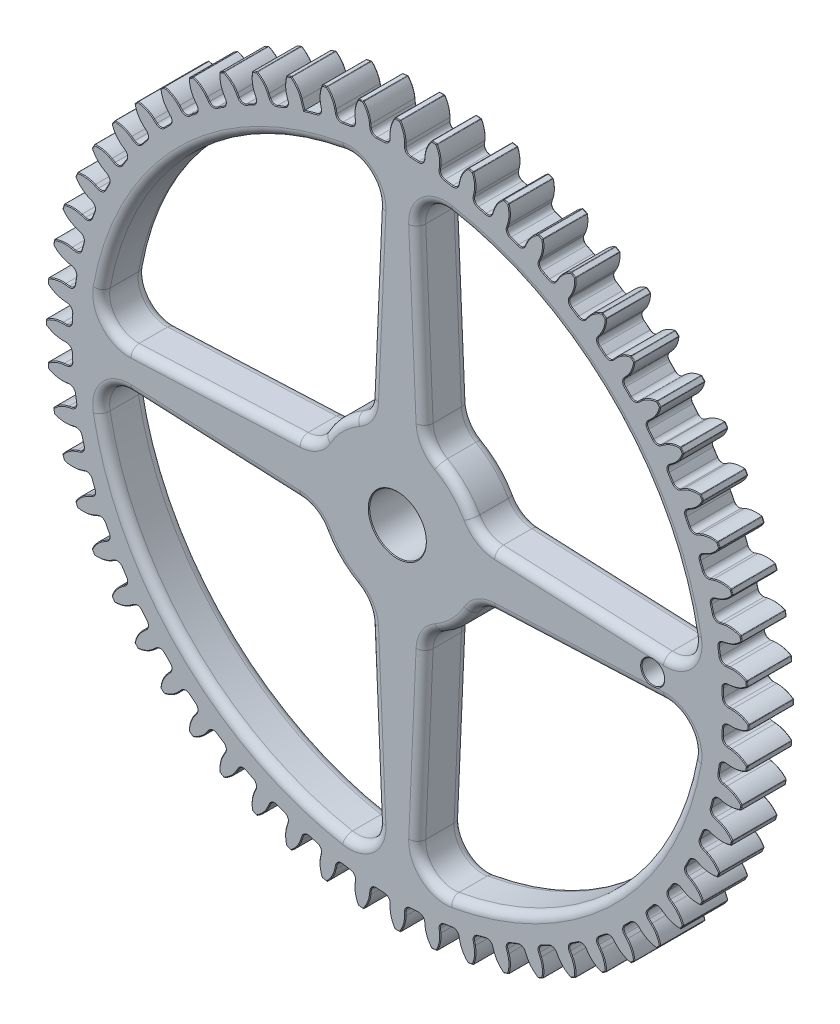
SolidWorks part; units mm, degrees
ref_plane "Спереди" through (0, 0, 0) normal (0, 0, 1) x (1, 0, 0)
ref_plane "Сверху" through (0, 0, 0) normal (0, 1, 0) x (1, 0, 0)
ref_plane "Справа" through (0, 0, 0) normal (1, 0, 0) x (0, 0, -1)
sketch "Эскиз1" plane through (0, 0, 0) normal (0, 0, 1) x (1, 0, 0)
  line L0 (0, 0) -> (0, 124) construction
  line L1 (0, 0) -> (-124, 0) construction
  line L2 (2.8, 118.1107) -> (2.8, 116.8103)
  line L3 (-2.8, 118.1107) -> (-2.8, 116.8103)
  line L4 (9.5613, 117.7564) -> (9.4253, 116.4631)
  line L5 (15.1306, 117.171) -> (14.9947, 115.8777)
  line L6 (21.8178, 116.1119) -> (21.5474, 114.8398)
  line L7 (27.2954, 114.9476) -> (27.025, 113.6755)
  line L8 (33.8353, 113.1952) -> (33.4334, 111.9584)
  line L9 (39.1612, 111.4647) -> (38.7593, 110.2279)
  line L10 (45.482, 109.0384) -> (44.9531, 107.8504)
  line L11 (50.5979, 106.7607) -> (50.0689, 105.5726)
  line L12 (56.6305, 103.6869) -> (55.9803, 102.5607)
  line L13 (61.4802, 100.8869) -> (60.83, 99.7607)
  line L14 (67.1585, 97.1994) -> (66.3941, 96.1473)
  line L15 (71.689, 93.9078) -> (70.9246, 92.8557)
  line L16 (76.9507, 89.647) -> (76.0805, 88.6805)
  line L17 (81.1123, 85.8998) -> (80.2421, 84.9334)
  line L18 (85.8998, 81.1123) -> (84.9334, 80.2421)
  line L19 (89.647, 76.9507) -> (88.6805, 76.0805)
  line L20 (93.9078, 71.689) -> (92.8557, 70.9246)
  line L21 (97.1994, 67.1585) -> (96.1473, 66.3941)
  line L22 (100.8869, 61.4802) -> (99.7607, 60.83)
  line L23 (103.6869, 56.6305) -> (102.5607, 55.9803)
  line L24 (106.7607, 50.5979) -> (105.5726, 50.0689)
  line L25 (109.0384, 45.482) -> (107.8504, 44.9531)
  line L26 (111.4647, 39.1612) -> (110.2279, 38.7593)
  line L27 (113.1952, 33.8353) -> (111.9584, 33.4334)
  line L28 (114.9476, 27.2954) -> (113.6755, 27.025)
  line L29 (116.1119, 21.8178) -> (114.8398, 21.5474)
  line L30 (117.171, 15.1306) -> (115.8777, 14.9947)
  line L31 (117.7564, 9.5613) -> (116.4631, 9.4253)
  line L32 (118.1107, 2.8) -> (116.8103, 2.8)
  line L33 (118.1107, -2.8) -> (116.8103, -2.8)
  line L34 (117.7564, -9.5613) -> (116.4631, -9.4253)
  line L35 (117.171, -15.1306) -> (115.8777, -14.9947)
  line L36 (116.1119, -21.8178) -> (114.8398, -21.5474)
  line L37 (114.9476, -27.2954) -> (113.6755, -27.025)
  line L38 (113.1952, -33.8353) -> (111.9584, -33.4334)
  line L39 (111.4647, -39.1612) -> (110.2279, -38.7593)
  line L40 (109.0384, -45.482) -> (107.8504, -44.9531)
  line L41 (106.7607, -50.5979) -> (105.5726, -50.0689)
  line L42 (103.6869, -56.6305) -> (102.5607, -55.9803)
  line L43 (100.8869, -61.4802) -> (99.7607, -60.83)
  line L44 (97.1994, -67.1585) -> (96.1473, -66.3941)
  line L45 (93.9078, -71.689) -> (92.8557, -70.9246)
  line L46 (89.647, -76.9507) -> (88.6805, -76.0805)
  line L47 (85.8998, -81.1123) -> (84.9334, -80.2421)
  line L48 (81.1123, -85.8998) -> (80.2421, -84.9334)
  line L49 (76.9507, -89.647) -> (76.0805, -88.6805)
  line L50 (71.689, -93.9078) -> (70.9246, -92.8557)
  line L51 (67.1585, -97.1994) -> (66.3941, -96.1473)
  line L52 (61.4802, -100.8869) -> (60.83, -99.7607)
  line L53 (56.6305, -103.6869) -> (55.9803, -102.5607)
  line L54 (50.5979, -106.7607) -> (50.0689, -105.5726)
  line L55 (45.482, -109.0384) -> (44.9531, -107.8504)
  line L56 (39.1612, -111.4647) -> (38.7593, -110.2279)
  line L57 (33.8353, -113.1952) -> (33.4334, -111.9584)
  line L58 (27.2954, -114.9476) -> (27.025, -113.6755)
  line L59 (21.8178, -116.1119) -> (21.5474, -114.8398)
  line L60 (15.1306, -117.171) -> (14.9947, -115.8777)
  line L61 (9.5613, -117.7564) -> (9.4253, -116.4631)
  line L62 (2.8, -118.1107) -> (2.8, -116.8103)
  line L63 (-2.8, -118.1107) -> (-2.8, -116.8103)
  line L64 (-9.5613, -117.7564) -> (-9.4253, -116.4631)
  line L65 (-15.1306, -117.171) -> (-14.9947, -115.8777)
  line L66 (-21.8178, -116.1119) -> (-21.5474, -114.8398)
  line L67 (-27.2954, -114.9476) -> (-27.025, -113.6755)
  line L68 (-33.8353, -113.1952) -> (-33.4334, -111.9584)
  line L69 (-39.1612, -111.4647) -> (-38.7593, -110.2279)
  line L70 (-45.482, -109.0384) -> (-44.9531, -107.8504)
  line L71 (-50.5979, -106.7607) -> (-50.0689, -105.5726)
  line L72 (-56.6305, -103.6869) -> (-55.9803, -102.5607)
  line L73 (-61.4802, -100.8869) -> (-60.83, -99.7607)
  line L74 (-67.1585, -97.1994) -> (-66.3941, -96.1473)
  line L75 (-71.689, -93.9078) -> (-70.9246, -92.8557)
  line L76 (-76.9507, -89.647) -> (-76.0805, -88.6805)
  line L77 (-81.1123, -85.8998) -> (-80.2421, -84.9334)
  line L78 (-85.8998, -81.1123) -> (-84.9334, -80.2421)
  line L79 (-89.647, -76.9507) -> (-88.6805, -76.0805)
  line L80 (-93.9078, -71.689) -> (-92.8557, -70.9246)
  line L81 (-97.1994, -67.1585) -> (-96.1473, -66.3941)
  line L82 (-100.8869, -61.4802) -> (-99.7607, -60.83)
  line L83 (-103.6869, -56.6305) -> (-102.5607, -55.9803)
  line L84 (-106.7607, -50.5979) -> (-105.5726, -50.0689)
  line L85 (-109.0384, -45.482) -> (-107.8504, -44.9531)
  line L86 (-111.4647, -39.1612) -> (-110.2279, -38.7593)
  line L87 (-113.1952, -33.8353) -> (-111.9584, -33.4334)
  line L88 (-114.9476, -27.2954) -> (-113.6755, -27.025)
  line L89 (-116.1119, -21.8178) -> (-114.8398, -21.5474)
  line L90 (-117.171, -15.1306) -> (-115.8777, -14.9947)
  line L91 (-117.7564, -9.5613) -> (-116.4631, -9.4253)
  line L92 (-118.1107, -2.8) -> (-116.8103, -2.8)
  line L93 (-118.1107, 2.8) -> (-116.8103, 2.8)
  line L94 (-117.7564, 9.5613) -> (-116.4631, 9.4253)
  line L95 (-117.171, 15.1306) -> (-115.8777, 14.9947)
  line L96 (-116.1119, 21.8178) -> (-114.8398, 21.5474)
  line L97 (-114.9476, 27.2954) -> (-113.6755, 27.025)
  line L98 (-113.1952, 33.8353) -> (-111.9584, 33.4334)
  line L99 (-111.4647, 39.1612) -> (-110.2279, 38.7593)
  line L100 (-109.0384, 45.482) -> (-107.8504, 44.9531)
  line L101 (-106.7607, 50.5979) -> (-105.5726, 50.0689)
  line L102 (-103.6869, 56.6305) -> (-102.5607, 55.9803)
  line L103 (-100.8869, 61.4802) -> (-99.7607, 60.83)
  line L104 (-97.1994, 67.1585) -> (-96.1473, 66.3941)
  line L105 (-93.9078, 71.689) -> (-92.8557, 70.9246)
  line L106 (-89.647, 76.9507) -> (-88.6805, 76.0805)
  line L107 (-85.8998, 81.1123) -> (-84.9334, 80.2421)
  line L108 (-81.1123, 85.8998) -> (-80.2421, 84.9334)
  line L109 (-76.9507, 89.647) -> (-76.0805, 88.6805)
  line L110 (-71.689, 93.9078) -> (-70.9246, 92.8557)
  line L111 (-67.1585, 97.1994) -> (-66.3941, 96.1473)
  line L112 (-61.4802, 100.8869) -> (-60.83, 99.7607)
  line L113 (-56.6305, 103.6869) -> (-55.9803, 102.5607)
  line L114 (-50.5979, 106.7607) -> (-50.0689, 105.5726)
  line L115 (-45.482, 109.0384) -> (-44.9531, 107.8504)
  line L116 (-39.1612, 111.4647) -> (-38.7593, 110.2279)
  line L117 (-33.8353, 113.1952) -> (-32.8635, 110.2043)
  line L118 (-27.2954, 114.9476) -> (-27.025, 113.6755)
  line L119 (-21.8178, 116.1119) -> (-21.5474, 114.8398)
  line L120 (-15.1306, 117.171) -> (-14.9947, 115.8777)
  line L121 (-9.5613, 117.7564) -> (-9.4253, 116.4631)
  arc A0 (0.8842, 123.9968) -> (-0.8842, 123.9968) centre (0, 0) ccw
  arc A1 (-4.6283, 114.9068) -> (-7.4081, 114.7611) centre (0, 0) ccw
  circle A2 centre (0, 0) radius 118.33 construction
  arc A3 (-0.8842, 123.9968) -> (-2.8, 118.1107) centre (7.2, 118.1107) ccw
  arc A4 (0.8842, 123.9968) -> (2.8, 118.1107) centre (-7.2, 118.1107) cw
  arc A5 (12.0819, 123.41) -> (9.5613, 117.7564) centre (19.5065, 116.7111) ccw
  arc A6 (13.8405, 123.2252) -> (12.0819, 123.41) centre (0, 0) ccw
  arc A7 (13.8405, 123.2252) -> (15.1306, 117.171) centre (5.1854, 118.2163) cw
  arc A8 (24.9155, 121.471) -> (21.8178, 116.1119) centre (31.5993, 114.0328) ccw
  arc A9 (26.6452, 121.1034) -> (24.9155, 121.471) centre (0, 0) ccw
  arc A10 (26.6452, 121.1034) -> (27.2954, 114.9476) centre (17.5139, 117.0267) cw
  arc A11 (37.4762, 118.2012) -> (33.8353, 113.1952) centre (43.3458, 110.1051) ccw
  arc A12 (39.158, 117.6548) -> (37.4762, 118.2012) centre (0, 0) ccw
  arc A13 (39.158, 117.6548) -> (39.1612, 111.4647) centre (29.6506, 114.5549) cw
  arc A14 (49.6263, 113.6364) -> (45.482, 109.0384) centre (54.6175, 104.971) ccw
  arc A15 (51.2418, 112.9171) -> (49.6263, 113.6364) centre (0, 0) ccw
  arc A16 (51.2418, 112.9171) -> (50.5979, 106.7607) centre (41.4624, 110.828) cw
  arc A17 (61.2327, 107.8265) -> (56.6305, 103.6869) centre (65.2908, 98.6869) ccw
  arc A18 (62.7641, 106.9423) -> (61.2327, 107.8265) centre (0, 0) ccw
  arc A19 (62.7641, 106.9423) -> (61.4802, 100.8869) centre (52.82, 105.8869) cw
  arc A20 (72.1682, 100.8353) -> (67.1585, 97.1994) centre (75.2487, 91.3215) ccw
  arc A21 (73.5988, 99.7959) -> (72.1682, 100.8353) centre (0, 0) ccw
  arc A22 (73.5988, 99.7959) -> (71.689, 93.9078) centre (63.5988, 99.7857) cw
  arc A23 (82.313, 92.7392) -> (76.9507, 89.647) centre (84.3822, 82.9557) ccw
  arc A24 (83.6272, 91.556) -> (82.313, 92.7392) centre (0, 0) ccw
  arc A25 (83.6272, 91.556) -> (81.1123, 85.8998) centre (73.6809, 92.5911) cw
  arc A26 (91.556, 83.6272) -> (85.8998, 81.1123) centre (92.5911, 73.6809) ccw
  arc A27 (92.7392, 82.313) -> (91.556, 83.6272) centre (0, 0) ccw
  arc A28 (92.7392, 82.313) -> (89.647, 76.9507) centre (82.9557, 84.3822) cw
  arc A29 (99.7959, 73.5988) -> (93.9078, 71.689) centre (99.7857, 63.5988) ccw
  arc A30 (100.8353, 72.1682) -> (99.7959, 73.5988) centre (0, 0) ccw
  arc A31 (100.8353, 72.1682) -> (97.1994, 67.1585) centre (91.3215, 75.2487) cw
  arc A32 (106.9423, 62.7641) -> (100.8869, 61.4802) centre (105.8869, 52.82) ccw
  arc A33 (107.8265, 61.2327) -> (106.9423, 62.7641) centre (0, 0) ccw
  arc A34 (107.8265, 61.2327) -> (103.6869, 56.6305) centre (98.6869, 65.2908) cw
  arc A35 (112.9171, 51.2418) -> (106.7607, 50.5979) centre (110.828, 41.4624) ccw
  arc A36 (113.6364, 49.6263) -> (112.9171, 51.2418) centre (0, 0) ccw
  arc A37 (113.6364, 49.6263) -> (109.0384, 45.482) centre (104.971, 54.6175) cw
  arc A38 (117.6548, 39.158) -> (111.4647, 39.1612) centre (114.5549, 29.6506) ccw
  arc A39 (118.2012, 37.4762) -> (117.6548, 39.158) centre (0, 0) ccw
  arc A40 (118.2012, 37.4762) -> (113.1952, 33.8353) centre (110.1051, 43.3458) cw
  arc A41 (121.1034, 26.6452) -> (114.9476, 27.2954) centre (117.0267, 17.5139) ccw
  arc A42 (121.471, 24.9155) -> (121.1034, 26.6452) centre (0, 0) ccw
  arc A43 (121.471, 24.9155) -> (116.1119, 21.8178) centre (114.0328, 31.5993) cw
  arc A44 (123.2252, 13.8405) -> (117.171, 15.1306) centre (118.2163, 5.1854) ccw
  arc A45 (123.41, 12.0819) -> (123.2252, 13.8405) centre (0, 0) ccw
  arc A46 (123.41, 12.0819) -> (117.7564, 9.5613) centre (116.7111, 19.5065) cw
  arc A47 (123.9968, 0.8842) -> (118.1107, 2.8) centre (118.1107, -7.2) ccw
  arc A48 (123.9968, -0.8842) -> (123.9968, 0.8842) centre (0, 0) ccw
  arc A49 (123.9968, -0.8842) -> (118.1107, -2.8) centre (118.1107, 7.2) cw
  arc A50 (123.41, -12.0819) -> (117.7564, -9.5613) centre (116.7111, -19.5065) ccw
  arc A51 (123.2252, -13.8405) -> (123.41, -12.0819) centre (0, 0) ccw
  arc A52 (123.2252, -13.8405) -> (117.171, -15.1306) centre (118.2163, -5.1854) cw
  arc A53 (121.471, -24.9155) -> (116.1119, -21.8178) centre (114.0328, -31.5993) ccw
  arc A54 (121.1034, -26.6452) -> (121.471, -24.9155) centre (0, 0) ccw
  arc A55 (121.1034, -26.6452) -> (114.9476, -27.2954) centre (117.0267, -17.5139) cw
  arc A56 (118.2012, -37.4762) -> (113.1952, -33.8353) centre (110.1051, -43.3458) ccw
  arc A57 (117.6548, -39.158) -> (118.2012, -37.4762) centre (0, 0) ccw
  arc A58 (117.6548, -39.158) -> (111.4647, -39.1612) centre (114.5549, -29.6506) cw
  arc A59 (113.6364, -49.6263) -> (109.0384, -45.482) centre (104.971, -54.6175) ccw
  arc A60 (112.9171, -51.2418) -> (113.6364, -49.6263) centre (0, 0) ccw
  arc A61 (112.9171, -51.2418) -> (106.7607, -50.5979) centre (110.828, -41.4624) cw
  arc A62 (107.8265, -61.2327) -> (103.6869, -56.6305) centre (98.6869, -65.2908) ccw
  arc A63 (106.9423, -62.7641) -> (107.8265, -61.2327) centre (0, 0) ccw
  arc A64 (106.9423, -62.7641) -> (100.8869, -61.4802) centre (105.8869, -52.82) cw
  arc A65 (100.8353, -72.1682) -> (97.1994, -67.1585) centre (91.3215, -75.2487) ccw
  arc A66 (99.7959, -73.5988) -> (100.8353, -72.1682) centre (0, 0) ccw
  arc A67 (99.7959, -73.5988) -> (93.9078, -71.689) centre (99.7857, -63.5988) cw
  arc A68 (92.7392, -82.313) -> (89.647, -76.9507) centre (82.9557, -84.3822) ccw
  arc A69 (91.556, -83.6272) -> (92.7392, -82.313) centre (0, 0) ccw
  arc A70 (91.556, -83.6272) -> (85.8998, -81.1123) centre (92.5911, -73.6809) cw
  arc A71 (83.6272, -91.556) -> (81.1123, -85.8998) centre (73.6809, -92.5911) ccw
  arc A72 (82.313, -92.7392) -> (83.6272, -91.556) centre (0, 0) ccw
  arc A73 (82.313, -92.7392) -> (76.9507, -89.647) centre (84.3822, -82.9557) cw
  arc A74 (73.5988, -99.7959) -> (71.689, -93.9078) centre (63.5988, -99.7857) ccw
  arc A75 (72.1682, -100.8353) -> (73.5988, -99.7959) centre (0, 0) ccw
  arc A76 (72.1682, -100.8353) -> (67.1585, -97.1994) centre (75.2487, -91.3215) cw
  arc A77 (62.7641, -106.9423) -> (61.4802, -100.8869) centre (52.82, -105.8869) ccw
  arc A78 (61.2327, -107.8265) -> (62.7641, -106.9423) centre (0, 0) ccw
  arc A79 (61.2327, -107.8265) -> (56.6305, -103.6869) centre (65.2908, -98.6869) cw
  arc A80 (51.2418, -112.9171) -> (50.5979, -106.7607) centre (41.4624, -110.828) ccw
  arc A81 (49.6263, -113.6364) -> (51.2418, -112.9171) centre (0, 0) ccw
  arc A82 (49.6263, -113.6364) -> (45.482, -109.0384) centre (54.6175, -104.971) cw
  arc A83 (39.158, -117.6548) -> (39.1612, -111.4647) centre (29.6506, -114.5549) ccw
  arc A84 (37.4762, -118.2012) -> (39.158, -117.6548) centre (0, 0) ccw
  arc A85 (37.4762, -118.2012) -> (33.8353, -113.1952) centre (43.3458, -110.1051) cw
  arc A86 (26.6452, -121.1034) -> (27.2954, -114.9476) centre (17.5139, -117.0267) ccw
  arc A87 (24.9155, -121.471) -> (26.6452, -121.1034) centre (0, 0) ccw
  arc A88 (24.9155, -121.471) -> (21.8178, -116.1119) centre (31.5993, -114.0328) cw
  arc A89 (13.8405, -123.2252) -> (15.1306, -117.171) centre (5.1854, -118.2163) ccw
  arc A90 (12.0819, -123.41) -> (13.8405, -123.2252) centre (0, 0) ccw
  arc A91 (12.0819, -123.41) -> (9.5613, -117.7564) centre (19.5065, -116.7111) cw
  arc A92 (0.8842, -123.9968) -> (2.8, -118.1107) centre (-7.2, -118.1107) ccw
  arc A93 (-0.8842, -123.9968) -> (0.8842, -123.9968) centre (0, 0) ccw
  arc A94 (-0.8842, -123.9968) -> (-2.8, -118.1107) centre (7.2, -118.1107) cw
  arc A95 (-12.0819, -123.41) -> (-9.5613, -117.7564) centre (-19.5065, -116.7111) ccw
  arc A96 (-13.8405, -123.2252) -> (-12.0819, -123.41) centre (0, 0) ccw
  arc A97 (-13.8405, -123.2252) -> (-15.1306, -117.171) centre (-5.1854, -118.2163) cw
  arc A98 (-24.9155, -121.471) -> (-21.8178, -116.1119) centre (-31.5993, -114.0328) ccw
  arc A99 (-26.6452, -121.1034) -> (-24.9155, -121.471) centre (0, 0) ccw
  arc A100 (-26.6452, -121.1034) -> (-27.2954, -114.9476) centre (-17.5139, -117.0267) cw
  arc A101 (-37.4762, -118.2012) -> (-33.8353, -113.1952) centre (-43.3458, -110.1051) ccw
  arc A102 (-39.158, -117.6548) -> (-37.4762, -118.2012) centre (0, 0) ccw
  arc A103 (-39.158, -117.6548) -> (-39.1612, -111.4647) centre (-29.6506, -114.5549) cw
  arc A104 (-49.6263, -113.6364) -> (-45.482, -109.0384) centre (-54.6175, -104.971) ccw
  arc A105 (-51.2418, -112.9171) -> (-49.6263, -113.6364) centre (0, 0) ccw
  arc A106 (-51.2418, -112.9171) -> (-50.5979, -106.7607) centre (-41.4624, -110.828) cw
  arc A107 (-61.2327, -107.8265) -> (-56.6305, -103.6869) centre (-65.2908, -98.6869) ccw
  arc A108 (-62.7641, -106.9423) -> (-61.2327, -107.8265) centre (0, 0) ccw
  arc A109 (-62.7641, -106.9423) -> (-61.4802, -100.8869) centre (-52.82, -105.8869) cw
  arc A110 (-72.1682, -100.8353) -> (-67.1585, -97.1994) centre (-75.2487, -91.3215) ccw
  arc A111 (-73.5988, -99.7959) -> (-72.1682, -100.8353) centre (0, 0) ccw
  arc A112 (-73.5988, -99.7959) -> (-71.689, -93.9078) centre (-63.5988, -99.7857) cw
  arc A113 (-82.313, -92.7392) -> (-76.9507, -89.647) centre (-84.3822, -82.9557) ccw
  arc A114 (-83.6272, -91.556) -> (-82.313, -92.7392) centre (0, 0) ccw
  arc A115 (-83.6272, -91.556) -> (-81.1123, -85.8998) centre (-73.6809, -92.5911) cw
  arc A116 (-91.556, -83.6272) -> (-85.8998, -81.1123) centre (-92.5911, -73.6809) ccw
  arc A117 (-92.7392, -82.313) -> (-91.556, -83.6272) centre (0, 0) ccw
  arc A118 (-92.7392, -82.313) -> (-89.647, -76.9507) centre (-82.9557, -84.3822) cw
  arc A119 (-99.7959, -73.5988) -> (-93.9078, -71.689) centre (-99.7857, -63.5988) ccw
  arc A120 (-100.8353, -72.1682) -> (-99.7959, -73.5988) centre (0, 0) ccw
  arc A121 (-100.8353, -72.1682) -> (-97.1994, -67.1585) centre (-91.3215, -75.2487) cw
  arc A122 (-106.9423, -62.7641) -> (-100.8869, -61.4802) centre (-105.8869, -52.82) ccw
  arc A123 (-107.8265, -61.2327) -> (-106.9423, -62.7641) centre (0, 0) ccw
  arc A124 (-107.8265, -61.2327) -> (-103.6869, -56.6305) centre (-98.6869, -65.2908) cw
  arc A125 (-112.9171, -51.2418) -> (-106.7607, -50.5979) centre (-110.828, -41.4624) ccw
  arc A126 (-113.6364, -49.6263) -> (-112.9171, -51.2418) centre (0, 0) ccw
  arc A127 (-113.6364, -49.6263) -> (-109.0384, -45.482) centre (-104.971, -54.6175) cw
  arc A128 (-117.6548, -39.158) -> (-111.4647, -39.1612) centre (-114.5549, -29.6506) ccw
  arc A129 (-118.2012, -37.4762) -> (-117.6548, -39.158) centre (0, 0) ccw
  arc A130 (-118.2012, -37.4762) -> (-113.1952, -33.8353) centre (-110.1051, -43.3458) cw
  arc A131 (-121.1034, -26.6452) -> (-114.9476, -27.2954) centre (-117.0267, -17.5139) ccw
  arc A132 (-121.471, -24.9155) -> (-121.1034, -26.6452) centre (0, 0) ccw
  arc A133 (-121.471, -24.9155) -> (-116.1119, -21.8178) centre (-114.0328, -31.5993) cw
  arc A134 (-123.2252, -13.8405) -> (-117.171, -15.1306) centre (-118.2163, -5.1854) ccw
  arc A135 (-123.41, -12.0819) -> (-123.2252, -13.8405) centre (0, 0) ccw
  arc A136 (-123.41, -12.0819) -> (-117.7564, -9.5613) centre (-116.7111, -19.5065) cw
  arc A137 (-123.9968, -0.8842) -> (-118.1107, -2.8) centre (-118.1107, 7.2) ccw
  arc A138 (-123.9968, 0.8842) -> (-123.9968, -0.8842) centre (0, 0) ccw
  arc A139 (-123.9968, 0.8842) -> (-118.1107, 2.8) centre (-118.1107, -7.2) cw
  arc A140 (-123.41, 12.0819) -> (-117.7564, 9.5613) centre (-116.7111, 19.5065) ccw
  arc A141 (-123.2252, 13.8405) -> (-123.41, 12.0819) centre (0, 0) ccw
  arc A142 (-123.2252, 13.8405) -> (-117.171, 15.1306) centre (-118.2163, 5.1854) cw
  arc A143 (-121.471, 24.9155) -> (-116.1119, 21.8178) centre (-114.0328, 31.5993) ccw
  arc A144 (-121.1034, 26.6452) -> (-121.471, 24.9155) centre (0, 0) ccw
  arc A145 (-121.1034, 26.6452) -> (-114.9476, 27.2954) centre (-117.0267, 17.5139) cw
  arc A146 (-118.2012, 37.4762) -> (-113.1952, 33.8353) centre (-110.1051, 43.3458) ccw
  arc A147 (-117.6548, 39.158) -> (-118.2012, 37.4762) centre (0, 0) ccw
  arc A148 (-117.6548, 39.158) -> (-111.4647, 39.1612) centre (-114.5549, 29.6506) cw
  arc A149 (-113.6364, 49.6263) -> (-109.0384, 45.482) centre (-104.971, 54.6175) ccw
  arc A150 (-112.9171, 51.2418) -> (-113.6364, 49.6263) centre (0, 0) ccw
  arc A151 (-112.9171, 51.2418) -> (-106.7607, 50.5979) centre (-110.828, 41.4624) cw
  arc A152 (-107.8265, 61.2327) -> (-103.6869, 56.6305) centre (-98.6869, 65.2908) ccw
  arc A153 (-106.9423, 62.7641) -> (-107.8265, 61.2327) centre (0, 0) ccw
  arc A154 (-106.9423, 62.7641) -> (-100.8869, 61.4802) centre (-105.8869, 52.82) cw
  arc A155 (-100.8353, 72.1682) -> (-97.1994, 67.1585) centre (-91.3215, 75.2487) ccw
  arc A156 (-99.7959, 73.5988) -> (-100.8353, 72.1682) centre (0, 0) ccw
  arc A157 (-99.7959, 73.5988) -> (-93.9078, 71.689) centre (-99.7857, 63.5988) cw
  arc A158 (-92.7392, 82.313) -> (-89.647, 76.9507) centre (-82.9557, 84.3822) ccw
  arc A159 (-91.556, 83.6272) -> (-92.7392, 82.313) centre (0, 0) ccw
  arc A160 (-91.556, 83.6272) -> (-85.8998, 81.1123) centre (-92.5911, 73.6809) cw
  arc A161 (-83.6272, 91.556) -> (-81.1123, 85.8998) centre (-73.6809, 92.5911) ccw
  arc A162 (-82.313, 92.7392) -> (-83.6272, 91.556) centre (0, 0) ccw
  arc A163 (-82.313, 92.7392) -> (-76.9507, 89.647) centre (-84.3822, 82.9557) cw
  arc A164 (-73.5988, 99.7959) -> (-71.689, 93.9078) centre (-63.5988, 99.7857) ccw
  arc A165 (-72.1682, 100.8353) -> (-73.5988, 99.7959) centre (0, 0) ccw
  arc A166 (-72.1682, 100.8353) -> (-67.1585, 97.1994) centre (-75.2487, 91.3215) cw
  arc A167 (-62.7641, 106.9423) -> (-61.4802, 100.8869) centre (-52.82, 105.8869) ccw
  arc A168 (-61.2327, 107.8265) -> (-62.7641, 106.9423) centre (0, 0) ccw
  arc A169 (-61.2327, 107.8265) -> (-56.6305, 103.6869) centre (-65.2908, 98.6869) cw
  arc A170 (-51.2418, 112.9171) -> (-50.5979, 106.7607) centre (-41.4624, 110.828) ccw
  arc A171 (-49.6263, 113.6364) -> (-51.2418, 112.9171) centre (0, 0) ccw
  arc A172 (-49.6263, 113.6364) -> (-45.482, 109.0384) centre (-54.6175, 104.971) cw
  arc A173 (-39.158, 117.6548) -> (-39.1612, 111.4647) centre (-29.6506, 114.5549) ccw
  arc A174 (-37.4762, 118.2012) -> (-39.158, 117.6548) centre (0, 0) ccw
  arc A175 (-37.4762, 118.2012) -> (-33.8353, 113.1952) centre (-43.3458, 110.1051) cw
  arc A176 (-26.6452, 121.1034) -> (-27.2954, 114.9476) centre (-17.5139, 117.0267) ccw
  arc A177 (-24.9155, 121.471) -> (-26.6452, 121.1034) centre (0, 0) ccw
  arc A178 (-24.9155, 121.471) -> (-21.8178, 116.1119) centre (-31.5993, 114.0328) cw
  arc A179 (-13.8405, 123.2252) -> (-15.1306, 117.171) centre (-5.1854, 118.2163) ccw
  arc A180 (-12.0819, 123.41) -> (-13.8405, 123.2252) centre (0, 0) ccw
  arc A181 (-12.0819, 123.41) -> (-9.5613, 117.7564) centre (-19.5065, 116.7111) cw
  arc A182 (-16.614, 113.7936) -> (-19.3633, 113.3581) centre (0, 0) ccw
  arc A183 (7.4081, 114.7611) -> (4.6283, 114.9068) centre (0, 0) ccw
  arc A184 (19.3633, 113.3581) -> (16.614, 113.7936) centre (0, 0) ccw
  arc A185 (31.1064, 110.7131) -> (28.4177, 111.4336) centre (0, 0) ccw
  arc A186 (42.5086, 106.8551) -> (39.91, 107.8527) centre (0, 0) ccw
  arc A187 (-28.4177, 111.4336) -> (-32.8635, 110.2043) centre (0, 0) ccw
  arc A188 (-39.91, 107.8527) -> (-42.5086, 106.8551) centre (0, 0) ccw
  arc A189 (-50.965, 103.0901) -> (-53.4452, 101.8264) centre (0, 0) ccw
  arc A190 (-61.4617, 97.1981) -> (-63.7961, 95.682) centre (0, 0) ccw
  arc A191 (-71.2849, 90.2411) -> (-73.4482, 88.4894) centre (0, 0) ccw
  arc A192 (-80.3272, 82.2955) -> (-82.2955, 80.3272) centre (0, 0) ccw
  arc A193 (-95.682, 63.7961) -> (-97.1981, 61.4617) centre (0, 0) ccw
  arc A194 (-88.4894, 73.4482) -> (-90.2411, 71.2849) centre (0, 0) ccw
  arc A195 (-101.8264, 53.4452) -> (-103.0901, 50.965) centre (0, 0) ccw
  arc A196 (-106.8551, 42.5086) -> (-107.8527, 39.91) centre (0, 0) ccw
  arc A197 (-110.7131, 31.1064) -> (-111.4336, 28.4177) centre (0, 0) ccw
  arc A198 (-113.3581, 19.3633) -> (-113.7936, 16.614) centre (0, 0) ccw
  arc A199 (-114.7611, 7.4081) -> (-114.9068, 4.6283) centre (0, 0) ccw
  arc A200 (-114.9068, -4.6283) -> (-114.7611, -7.4081) centre (0, 0) ccw
  arc A201 (53.4452, 101.8264) -> (50.965, 103.0901) centre (0, 0) ccw
  arc A202 (63.7961, 95.682) -> (61.4617, 97.1981) centre (0, 0) ccw
  arc A203 (73.4482, 88.4894) -> (71.2849, 90.2411) centre (0, 0) ccw
  arc A204 (82.2955, 80.3272) -> (80.3272, 82.2955) centre (0, 0) ccw
  arc A205 (90.2411, 71.2849) -> (88.4894, 73.4482) centre (0, 0) ccw
  arc A206 (97.1981, 61.4617) -> (95.682, 63.7961) centre (0, 0) ccw
  arc A207 (103.0901, 50.965) -> (101.8264, 53.4452) centre (0, 0) ccw
  arc A208 (107.8527, 39.91) -> (106.8551, 42.5086) centre (0, 0) ccw
  arc A209 (111.4336, 28.4177) -> (110.7131, 31.1064) centre (0, 0) ccw
  arc A210 (113.7936, 16.614) -> (113.3581, 19.3633) centre (0, 0) ccw
  arc A211 (114.9068, 4.6283) -> (114.7611, 7.4081) centre (0, 0) ccw
  arc A212 (114.7611, -7.4081) -> (114.9068, -4.6283) centre (0, 0) ccw
  arc A213 (113.3581, -19.3633) -> (113.7936, -16.614) centre (0, 0) ccw
  arc A214 (110.7131, -31.1064) -> (111.4336, -28.4177) centre (0, 0) ccw
  arc A215 (106.8551, -42.5086) -> (107.8527, -39.91) centre (0, 0) ccw
  arc A216 (101.8264, -53.4452) -> (103.0901, -50.965) centre (0, 0) ccw
  arc A217 (95.682, -63.7961) -> (97.1981, -61.4617) centre (0, 0) ccw
  arc A218 (88.4894, -73.4482) -> (90.2411, -71.2849) centre (0, 0) ccw
  arc A219 (80.3272, -82.2955) -> (82.2955, -80.3272) centre (0, 0) ccw
  arc A220 (71.2849, -90.2411) -> (73.4482, -88.4894) centre (0, 0) ccw
  arc A221 (61.4617, -97.1981) -> (63.7961, -95.682) centre (0, 0) ccw
  arc A222 (50.965, -103.0901) -> (53.4452, -101.8264) centre (0, 0) ccw
  arc A223 (39.91, -107.8527) -> (42.5086, -106.8551) centre (0, 0) ccw
  arc A224 (28.4177, -111.4336) -> (31.1064, -110.7131) centre (0, 0) ccw
  arc A225 (16.614, -113.7936) -> (19.3633, -113.3581) centre (0, 0) ccw
  arc A226 (4.6283, -114.9068) -> (7.4081, -114.7611) centre (0, 0) ccw
  arc A227 (-7.4081, -114.7611) -> (-4.6283, -114.9068) centre (0, 0) ccw
  arc A228 (-19.3633, -113.3581) -> (-16.614, -113.7936) centre (0, 0) ccw
  arc A229 (-31.1064, -110.7131) -> (-28.4177, -111.4336) centre (0, 0) ccw
  arc A230 (-42.5086, -106.8551) -> (-39.91, -107.8527) centre (0, 0) ccw
  arc A231 (-53.4452, -101.8264) -> (-50.965, -103.0901) centre (0, 0) ccw
  arc A232 (-63.7961, -95.682) -> (-61.4617, -97.1981) centre (0, 0) ccw
  arc A233 (-73.4482, -88.4894) -> (-71.2849, -90.2411) centre (0, 0) ccw
  arc A234 (-82.2955, -80.3272) -> (-80.3272, -82.2955) centre (0, 0) ccw
  arc A235 (-90.2411, -71.2849) -> (-88.4894, -73.4482) centre (0, 0) ccw
  arc A236 (-97.1981, -61.4617) -> (-95.682, -63.7961) centre (0, 0) ccw
  arc A237 (-103.0901, -50.965) -> (-101.8264, -53.4452) centre (0, 0) ccw
  arc A238 (-107.8527, -39.91) -> (-106.8551, -42.5086) centre (0, 0) ccw
  arc A239 (-111.4336, -28.4177) -> (-110.7131, -31.1064) centre (0, 0) ccw
  arc A240 (-113.7936, -16.614) -> (-113.3581, -19.3633) centre (0, 0) ccw
  arc A241 (38.7593, 110.2279) -> (39.91, 107.8527) centre (40.5711, 109.6393) ccw
  arc A242 (44.9531, 107.8504) -> (42.5086, 106.8551) centre (43.2128, 108.6252) cw
  arc A243 (50.0689, 105.5726) -> (50.965, 103.0901) centre (51.8093, 104.7978) ccw
  arc A244 (55.9803, 102.5607) -> (53.4452, 101.8264) centre (54.3305, 103.5132) cw
  arc A245 (60.83, 99.7607) -> (61.4617, 97.1981) centre (62.4798, 98.8082) ccw
  arc A246 (66.3941, 96.1473) -> (63.7961, 95.682) centre (64.8529, 97.267) cw
  arc A247 (70.9246, 92.8557) -> (71.2849, 90.2411) centre (72.4658, 91.736) ccw
  arc A248 (76.0805, 88.6805) -> (73.4482, 88.4894) centre (74.6648, 89.9552) cw
  arc A249 (80.2421, 84.9334) -> (80.3272, 82.2955) centre (81.6578, 83.6587) ccw
  arc A250 (84.9334, 80.2421) -> (82.2955, 80.3272) centre (83.6587, 81.6578) cw
  arc A251 (88.6805, 76.0805) -> (88.4894, 73.4482) centre (89.9552, 74.6648) ccw
  arc A252 (92.8557, 70.9246) -> (90.2411, 71.2849) centre (91.736, 72.4658) cw
  arc A253 (96.1473, 66.3941) -> (95.682, 63.7961) centre (97.267, 64.8529) ccw
  arc A254 (99.7607, 60.83) -> (97.1981, 61.4617) centre (98.8082, 62.4798) cw
  arc A255 (102.5607, 55.9803) -> (101.8264, 53.4452) centre (103.5132, 54.3305) ccw
  arc A256 (105.5726, 50.0689) -> (103.0901, 50.965) centre (104.7978, 51.8093) cw
  arc A257 (107.8504, 44.9531) -> (106.8551, 42.5086) centre (108.6252, 43.2128) ccw
  arc A258 (110.2279, 38.7593) -> (107.8527, 39.91) centre (109.6393, 40.5711) cw
  arc A259 (111.9584, 33.4334) -> (110.7131, 31.1064) centre (112.5471, 31.6216) ccw
  arc A260 (113.6755, 27.025) -> (111.4336, 28.4177) centre (113.2795, 28.8884) cw
  arc A261 (114.8398, 21.5474) -> (113.3581, 19.3633) centre (115.2359, 19.684) ccw
  arc A262 (115.8777, 14.9947) -> (113.7936, 16.614) centre (115.6786, 16.8892) cw
  arc A263 (116.4631, 9.4253) -> (114.7611, 7.4081) centre (116.6622, 7.5308) ccw
  arc A264 (116.8103, 2.8) -> (114.9068, 4.6283) centre (116.8103, 4.705) cw
  arc A265 (116.8103, -2.8) -> (114.9068, -4.6283) centre (116.8103, -4.705) ccw
  arc A266 (116.4631, -9.4253) -> (114.7611, -7.4081) centre (116.6622, -7.5308) cw
  arc A267 (115.8777, -14.9947) -> (113.7936, -16.614) centre (115.6786, -16.8892) ccw
  arc A268 (114.8398, -21.5474) -> (113.3581, -19.3633) centre (115.2359, -19.684) cw
  arc A269 (113.6755, -27.025) -> (111.4336, -28.4177) centre (113.2795, -28.8884) ccw
  arc A270 (111.9584, -33.4334) -> (110.7131, -31.1064) centre (112.5471, -31.6216) cw
  arc A271 (110.2279, -38.7593) -> (107.8527, -39.91) centre (109.6393, -40.5711) ccw
  arc A272 (107.8504, -44.9531) -> (106.8551, -42.5086) centre (108.6252, -43.2128) cw
  arc A273 (105.5726, -50.0689) -> (103.0901, -50.965) centre (104.7978, -51.8093) ccw
  arc A274 (102.5607, -55.9803) -> (101.8264, -53.4452) centre (103.5132, -54.3305) cw
  arc A275 (99.7607, -60.83) -> (97.1981, -61.4617) centre (98.8082, -62.4798) ccw
  arc A276 (96.1473, -66.3941) -> (95.682, -63.7961) centre (97.267, -64.8529) cw
  arc A277 (92.8557, -70.9246) -> (90.2411, -71.2849) centre (91.736, -72.4658) ccw
  arc A278 (88.6805, -76.0805) -> (88.4894, -73.4482) centre (89.9552, -74.6648) cw
  arc A279 (84.9334, -80.2421) -> (82.2955, -80.3272) centre (83.6587, -81.6578) ccw
  arc A280 (80.2421, -84.9334) -> (80.3272, -82.2955) centre (81.6578, -83.6587) cw
  arc A281 (76.0805, -88.6805) -> (73.4482, -88.4894) centre (74.6648, -89.9552) ccw
  arc A282 (70.9246, -92.8557) -> (71.2849, -90.2411) centre (72.4658, -91.736) cw
  arc A283 (66.3941, -96.1473) -> (63.7961, -95.682) centre (64.8529, -97.267) ccw
  arc A284 (60.83, -99.7607) -> (61.4617, -97.1981) centre (62.4798, -98.8082) cw
  arc A285 (55.9803, -102.5607) -> (53.4452, -101.8264) centre (54.3305, -103.5132) ccw
  arc A286 (50.0689, -105.5726) -> (50.965, -103.0901) centre (51.8093, -104.7978) cw
  arc A287 (44.9531, -107.8504) -> (42.5086, -106.8551) centre (43.2128, -108.6252) ccw
  arc A288 (38.7593, -110.2279) -> (39.91, -107.8527) centre (40.5711, -109.6393) cw
  arc A289 (33.4334, -111.9584) -> (31.1064, -110.7131) centre (31.6216, -112.5471) ccw
  arc A290 (27.025, -113.6755) -> (28.4177, -111.4336) centre (28.8884, -113.2795) cw
  arc A291 (21.5474, -114.8398) -> (19.3633, -113.3581) centre (19.684, -115.2359) ccw
  arc A292 (14.9947, -115.8777) -> (16.614, -113.7936) centre (16.8892, -115.6786) cw
  arc A293 (9.4253, -116.4631) -> (7.4081, -114.7611) centre (7.5308, -116.6622) ccw
  arc A294 (2.8, -116.8103) -> (4.6283, -114.9068) centre (4.705, -116.8103) cw
  arc A295 (-2.8, -116.8103) -> (-4.6283, -114.9068) centre (-4.705, -116.8103) ccw
  arc A296 (-9.4253, -116.4631) -> (-7.4081, -114.7611) centre (-7.5308, -116.6622) cw
  arc A297 (-14.9947, -115.8777) -> (-16.614, -113.7936) centre (-16.8892, -115.6786) ccw
  arc A298 (-21.5474, -114.8398) -> (-19.3633, -113.3581) centre (-19.684, -115.2359) cw
  arc A299 (-27.025, -113.6755) -> (-28.4177, -111.4336) centre (-28.8884, -113.2795) ccw
  arc A300 (-33.4334, -111.9584) -> (-31.1064, -110.7131) centre (-31.6216, -112.5471) cw
  arc A301 (-38.7593, -110.2279) -> (-39.91, -107.8527) centre (-40.5711, -109.6393) ccw
  arc A302 (-44.9531, -107.8504) -> (-42.5086, -106.8551) centre (-43.2128, -108.6252) cw
  arc A303 (-50.0689, -105.5726) -> (-50.965, -103.0901) centre (-51.8093, -104.7978) ccw
  arc A304 (-55.9803, -102.5607) -> (-53.4452, -101.8264) centre (-54.3305, -103.5132) cw
  arc A305 (-60.83, -99.7607) -> (-61.4617, -97.1981) centre (-62.4798, -98.8082) ccw
  arc A306 (-66.3941, -96.1473) -> (-63.7961, -95.682) centre (-64.8529, -97.267) cw
  arc A307 (-70.9246, -92.8557) -> (-71.2849, -90.2411) centre (-72.4658, -91.736) ccw
  arc A308 (-76.0805, -88.6805) -> (-73.4482, -88.4894) centre (-74.6648, -89.9552) cw
  arc A309 (-80.2421, -84.9334) -> (-80.3272, -82.2955) centre (-81.6578, -83.6587) ccw
  arc A310 (-84.9334, -80.2421) -> (-82.2955, -80.3272) centre (-83.6587, -81.6578) cw
  arc A311 (-88.6805, -76.0805) -> (-88.4894, -73.4482) centre (-89.9552, -74.6648) ccw
  arc A312 (-92.8557, -70.9246) -> (-90.2411, -71.2849) centre (-91.736, -72.4658) cw
  arc A313 (-96.1473, -66.3941) -> (-95.682, -63.7961) centre (-97.267, -64.8529) ccw
  arc A314 (-99.7607, -60.83) -> (-97.1981, -61.4617) centre (-98.8082, -62.4798) cw
  arc A315 (-102.5607, -55.9803) -> (-101.8264, -53.4452) centre (-103.5132, -54.3305) ccw
  arc A316 (-105.5726, -50.0689) -> (-103.0901, -50.965) centre (-104.7978, -51.8093) cw
  arc A317 (-107.8504, -44.9531) -> (-106.8551, -42.5086) centre (-108.6252, -43.2128) ccw
  arc A318 (-110.2279, -38.7593) -> (-107.8527, -39.91) centre (-109.6393, -40.5711) cw
  arc A319 (-111.9584, -33.4334) -> (-110.7131, -31.1064) centre (-112.5471, -31.6216) ccw
  arc A320 (-113.6755, -27.025) -> (-111.4336, -28.4177) centre (-113.2795, -28.8884) cw
  arc A321 (-114.8398, -21.5474) -> (-113.3581, -19.3633) centre (-115.2359, -19.684) ccw
  arc A322 (-115.8777, -14.9947) -> (-113.7936, -16.614) centre (-115.6786, -16.8892) cw
  arc A323 (-116.4631, -9.4253) -> (-114.7611, -7.4081) centre (-116.6622, -7.5308) ccw
  arc A324 (-116.8103, -2.8) -> (-114.9068, -4.6283) centre (-116.8103, -4.705) cw
  arc A325 (-116.8103, 2.8) -> (-114.9068, 4.6283) centre (-116.8103, 4.705) ccw
  arc A326 (-116.4631, 9.4253) -> (-114.7611, 7.4081) centre (-116.6622, 7.5308) cw
  arc A327 (-115.8777, 14.9947) -> (-113.7936, 16.614) centre (-115.6786, 16.8892) ccw
  arc A328 (-114.8398, 21.5474) -> (-113.3581, 19.3633) centre (-115.2359, 19.684) cw
  arc A329 (-113.6755, 27.025) -> (-111.4336, 28.4177) centre (-113.2795, 28.8884) ccw
  arc A330 (-111.9584, 33.4334) -> (-110.7131, 31.1064) centre (-112.5471, 31.6216) cw
  arc A331 (-110.2279, 38.7593) -> (-107.8527, 39.91) centre (-109.6393, 40.5711) ccw
  arc A332 (-107.8504, 44.9531) -> (-106.8551, 42.5086) centre (-108.6252, 43.2128) cw
  arc A333 (-105.5726, 50.0689) -> (-103.0901, 50.965) centre (-104.7978, 51.8093) ccw
  arc A334 (-102.5607, 55.9803) -> (-101.8264, 53.4452) centre (-103.5132, 54.3305) cw
  arc A335 (-99.7607, 60.83) -> (-97.1981, 61.4617) centre (-98.8082, 62.4798) ccw
  arc A336 (-96.1473, 66.3941) -> (-95.682, 63.7961) centre (-97.267, 64.8529) cw
  arc A337 (-92.8557, 70.9246) -> (-90.2411, 71.2849) centre (-91.736, 72.4658) ccw
  arc A338 (-88.6805, 76.0805) -> (-88.4894, 73.4482) centre (-89.9552, 74.6648) cw
  arc A339 (-84.9334, 80.2421) -> (-82.2955, 80.3272) centre (-83.6587, 81.6578) ccw
  arc A340 (-80.2421, 84.9334) -> (-80.3272, 82.2955) centre (-81.6578, 83.6587) cw
  arc A341 (-76.0805, 88.6805) -> (-73.4482, 88.4894) centre (-74.6648, 89.9552) ccw
  arc A342 (-66.3941, 96.1473) -> (-63.7961, 95.682) centre (-64.8529, 97.267) ccw
  arc A343 (-70.9246, 92.8557) -> (-71.2849, 90.2411) centre (-72.4658, 91.736) cw
  arc A344 (-60.83, 99.7607) -> (-61.4617, 97.1981) centre (-62.4798, 98.8082) cw
  arc A345 (-55.9803, 102.5607) -> (-53.4452, 101.8264) centre (-54.3305, 103.5132) ccw
  arc A346 (-50.0689, 105.5726) -> (-50.965, 103.0901) centre (-51.8093, 104.7978) cw
  arc A347 (-38.7593, 110.2279) -> (-39.91, 107.8527) centre (-40.5711, 109.6393) cw
  arc A348 (-44.9531, 107.8504) -> (-42.5086, 106.8551) centre (-43.2128, 108.6252) ccw
  arc A349 (33.4334, 111.9584) -> (31.1064, 110.7131) centre (31.6216, 112.5471) cw
  arc A350 (27.025, 113.6755) -> (28.4177, 111.4336) centre (28.8884, 113.2795) ccw
  arc A351 (21.5474, 114.8398) -> (19.3633, 113.3581) centre (19.684, 115.2359) cw
  arc A352 (14.9947, 115.8777) -> (16.614, 113.7936) centre (16.8892, 115.6786) ccw
  arc A353 (9.4253, 116.4631) -> (7.4081, 114.7611) centre (7.5308, 116.6622) cw
  arc A354 (2.8, 116.8103) -> (4.6283, 114.9068) centre (4.705, 116.8103) ccw
  arc A355 (-27.025, 113.6755) -> (-28.4177, 111.4336) centre (-28.8884, 113.2795) cw
  arc A356 (-21.5474, 114.8398) -> (-19.3633, 113.3581) centre (-19.684, 115.2359) ccw
  arc A357 (-14.9947, 115.8777) -> (-16.614, 113.7936) centre (-16.8892, 115.6786) cw
  arc A358 (-9.4253, 116.4631) -> (-7.4081, 114.7611) centre (-7.5308, 116.6622) ccw
  arc A359 (-2.8, 116.8103) -> (-4.6283, 114.9068) centre (-4.705, 116.8103) cw
  circle A360 centre (0, 0) radius 10
  point P772 (2.8, 114.9659)
  point P783 (-2.8, 114.9659)
  dimension "D1" = 248
  dimension "D2" = 230
  dimension "D3" = 236.66
  dimension "D5" = 20
  dimension "D7" = 1.905
  dimension "D8" = 20
  dimension "D4" = 5.6
  dimension "D6" = 60
extrude "Бобышка-Вытянуть1" add sketch "Эскиз1" along normal mid plane 16
sketch "Эскиз2" plane through (0, 0, 0) normal (0, 0, 1) x (1, 0, 0)
  line L0 (0, 0) -> (0, 106) construction
  line L1 (0, 0) -> (-106, 0) construction
  line L2 (-7.0132, 94.0459) -> (-9.6161, 34.429)
  line L3 (-94.0459, 7.0132) -> (-34.429, 9.6161)
  line L4 (-6.5, 110.2192) -> (-6.5, 90.2959) construction
  line L5 (-109.5933, 6.5) -> (-94.9944, 6.5) construction
  line L6 (94.0459, 7.0132) -> (34.429, 9.6161)
  line L7 (7.0132, 94.0459) -> (9.6161, 34.429)
  line L8 (7.0132, -94.0459) -> (9.6161, -34.429)
  line L9 (94.0459, -7.0132) -> (34.429, -9.6161)
  line L10 (-94.0459, -7.0132) -> (-34.429, -9.6161)
  line L11 (-7.0132, -94.0459) -> (-9.6161, -34.429)
  arc A0 (-18.7749, 104.324) -> (-104.324, 18.7749) centre (0, 0) ccw
  arc A1 (-14.705, 26.1489) -> (-26.1489, 14.705) centre (0, 0) ccw
  arc A2 (-7.0132, 94.0459) -> (-18.7749, 104.324) centre (-17.0037, 94.4821) ccw
  arc A3 (-9.6161, 34.429) -> (-14.705, 26.1489) centre (-19.6066, 34.8652) cw
  arc A4 (-34.429, 9.6161) -> (-26.1489, 14.705) centre (-34.8652, 19.6066) ccw
  arc A5 (-94.0459, 7.0132) -> (-104.324, 18.7749) centre (-94.4821, 17.0037) cw
  arc A6 (9.6161, 34.429) -> (14.705, 26.1489) centre (19.6066, 34.8652) ccw
  arc A7 (26.1489, 14.705) -> (14.705, 26.1489) centre (0, 0) ccw
  arc A8 (34.429, 9.6161) -> (26.1489, 14.705) centre (34.8652, 19.6066) cw
  arc A9 (7.0132, 94.0459) -> (18.7749, 104.324) centre (17.0037, 94.4821) cw
  arc A10 (94.0459, 7.0132) -> (104.324, 18.7749) centre (94.4821, 17.0037) ccw
  arc A11 (104.324, 18.7749) -> (18.7749, 104.324) centre (0, 0) ccw
  arc A12 (34.429, -9.6161) -> (26.1489, -14.705) centre (34.8652, -19.6066) ccw
  arc A13 (14.705, -26.1489) -> (26.1489, -14.705) centre (0, 0) ccw
  arc A14 (9.6161, -34.429) -> (14.705, -26.1489) centre (19.6066, -34.8652) cw
  arc A15 (94.0459, -7.0132) -> (104.324, -18.7749) centre (94.4821, -17.0037) cw
  arc A16 (7.0132, -94.0459) -> (18.7749, -104.324) centre (17.0037, -94.4821) ccw
  arc A17 (18.7749, -104.324) -> (104.324, -18.7749) centre (0, 0) ccw
  arc A18 (-9.6161, -34.429) -> (-14.705, -26.1489) centre (-19.6066, -34.8652) ccw
  arc A19 (-26.1489, -14.705) -> (-14.705, -26.1489) centre (0, 0) ccw
  arc A20 (-34.429, -9.6161) -> (-26.1489, -14.705) centre (-34.8652, -19.6066) cw
  arc A21 (-7.0132, -94.0459) -> (-18.7749, -104.324) centre (-17.0037, -94.4821) cw
  arc A22 (-94.0459, -7.0132) -> (-104.324, -18.7749) centre (-94.4821, -17.0037) ccw
  arc A23 (-104.324, -18.7749) -> (-18.7749, -104.324) centre (0, 0) ccw
  point P14 (-6.5, 105.8005)
  point P21 (-105.8005, 6.5)
  dimension "D1" = 60
  dimension "D2" = 212
  dimension "D7" = 10
  dimension "D3" = 2.5
  dimension "D4" = 2.5
  dimension "D5" = 6.5
  dimension "D6" = 6.5
  dimension "D8" = 4
extrude "Вырез-Вытянуть1" cut sketch "Эскиз2" against normal mid plane 16
sketch "Эскиз3" plane through (0, 0, 0) normal (0, 0, 1) x (1, 0, 0)
  circle A0 centre (90.1, 0) radius 4
  dimension "D1" = 8
  dimension "D2" = 90.1
extrude "Вырез-Вытянуть2" cut sketch "Эскиз3" against normal mid plane 16
fillet "Скругление1" radius 3 64 edges at (11.087, -29.6291, -8) (21.2132, -21.2132, -8) (29.6291, -11.087, -8) (64.2375, -8.3147, -8) (102.0122, -10.4235, -8) (74.9533, -74.9533, -8) (10.4235, -102.0122, -8) (11.087, -29.6291, 8) (21.2132, -21.2132, 8) (29.6291, -11.087, 8) (64.2375, -8.3147, 8) (102.0122, -10.4235, 8) (74.9533, -74.9533, 8) (10.4235, -102.0122, 8) (-102.0122, -10.4235, -8) (-64.2375, -8.3147, -8) (-29.6291, -11.087, -8) (-21.2132, -21.2132, -8) (-11.087, -29.6291, -8) (-8.3147, -64.2375, -8) (-10.4235, -102.0122, -8) (-102.0122, -10.4235, 8) (-64.2375, -8.3147, 8) (-29.6291, -11.087, 8) (-21.2132, -21.2132, 8) (-11.087, -29.6291, 8) (-8.3147, -64.2375, 8) (-10.4235, -102.0122, 8) (-102.0122, 10.4235, -8) (-74.9533, 74.9533, -8) (-10.4235, 102.0122, -8) (-8.3147, 64.2375, -8) (-11.087, 29.6291, -8) (-21.2132, 21.2132, -8) (-29.6291, 11.087, -8) (-102.0122, 10.4235, 8) (-74.9533, 74.9533, 8) (-10.4235, 102.0122, 8) (-8.3147, 64.2375, 8) (-11.087, 29.6291, 8) (-21.2132, 21.2132, 8) (-29.6291, 11.087, 8) (10.4235, 102.0122, -8) (74.9533, 74.9533, -8) (102.0122, 10.4235, -8) (64.2375, 8.3147, -8) (29.6291, 11.087, -8) (21.2132, 21.2132, -8) (11.087, 29.6291, -8) (10.4235, 102.0122, 8) (74.9533, 74.9533, 8) (102.0122, 10.4235, 8) (64.2375, 8.3147, 8) (29.6291, 11.087, 8) (21.2132, 21.2132, 8) (11.087, 29.6291, 8) (8.3147, -64.2375, -8) (8.3147, -64.2375, 8) (-74.9533, -74.9533, -8) (-74.9533, -74.9533, 8) (-64.2375, 8.3147, -8) (-64.2375, 8.3147, 8) (8.3147, 64.2375, -8) (8.3147, 64.2375, 8)
chamfer "Фаска1" distance 0.25 angle 45 400 edges at (10, 0, -8) (38.9603, 110.8463, -8) (39.6506, 114.56, -8) (38.3181, 117.931, -8) (35.2587, 115.9871, -8) (33.6343, 112.5768, -8) (32.5205, 110.8675, -8) (29.7642, 111.0815, -8) (27.2702, 112.2743, -8) (27.1602, 114.3116, -8) (27.4586, 118.0771, -8) (25.781, 121.2903, -8) (22.9416, 119.0372, -8) (21.6826, 115.4759, -8) (20.7535, 113.6595, -8) (17.99, 113.5842, -8) (15.3849, 114.5098, -8) (15.0626, 116.5244, -8) (14.9658, 120.3004, -8) (12.9615, 123.3207, -8) (10.3731, 120.7831, -8) (9.4933, 117.1097, -8) (8.7592, 115.2062, -8) (6.0186, 114.8424, -8) (3.3311, 115.4906, -8) (2.8, 117.4605, -8) (2.309, 121.2058, -8) (0, 124, -8) (-2.309, 121.2058, -8) (-2.8, 117.4605, -8) (-3.3311, 115.4906, -8) (-6.0186, 114.8424, -8) (-8.7592, 115.2062, -8) (-9.4933, 117.1097, -8) (-10.3731, 120.7831, -8) (-12.9615, 123.3207, -8) (-14.9658, 120.3004, -8) (-15.0626, 116.5244, -8) (-15.3849, 114.5098, -8) (-17.99, 113.5842, -8) (-20.7535, 113.6595, -8) (-21.6826, 115.4759, -8) (-22.9416, 119.0372, -8) (-25.781, 121.2903, -8) (-27.4586, 118.0771, -8) (-27.1602, 114.3116, -8) (-27.2702, 112.2743, -8) (-30.6467, 110.8412, -8) (-33.3494, 111.6998, -8) (-35.2587, 115.9871, -8) (-38.3181, 117.931, -8) (-39.6506, 114.56, -8) (-38.9603, 110.8463, -8) (-38.8567, 108.8087, -8) (-41.2123, 107.3617, -8) (-43.9311, 106.8608, -8) (-45.2176, 108.4444, -8) (-47.1895, 111.6661, -8) (-50.4353, 113.2796, -8) (-51.4082, 109.7878, -8) (-50.3334, 106.1667, -8) (-50.0174, 104.151, -8) (-52.2089, 102.4658, -8) (-54.8605, 101.6834, -8) (-56.3054, 103.1238, -8) (-58.6032, 106.1218, -8) (-62, 107.3872, -8) (-62.6025, 103.8128, -8) (-61.1551, 100.3238, -8) (-60.6302, 98.3523, -8) (-62.6335, 96.4471, -8) (-65.1888, 95.3919, -8) (-66.7763, 96.6734, -8) (-69.375, 99.4147, -8) (-72.8854, 100.3181, -8) (-73.111, 96.7003, -8) (-71.3068, 93.3818, -8) (-70.5786, 91.4759, -8) (-72.3718, 89.3718, -8) (-74.8028, 88.0552, -8) (-76.5156, 89.1637, -8) (-79.3866, 91.6185, -8) (-82.9722, 92.15, -8) (-82.8184, 88.5284, -8) (-80.6772, 85.4166, -8) (-79.7538, 83.5973, -8) (-81.3173, 81.3173, -8) (-83.5973, 79.7538, -8) (-85.4166, 80.6772, -8) (-88.5284, 82.8184, -8) (-92.15, 82.9722, -8) (-91.6185, 79.3866, -8) (-89.1637, 76.5156, -8) (-88.0552, 74.8028, -8) (-89.3718, 72.3718, -8) (-91.4759, 70.5786, -8) (-93.3818, 71.3068, -8) (-96.7003, 73.111, -8) (-100.3181, 72.8854, -8) (-99.4147, 69.375, -8) (-96.6734, 66.7763, -8) (-95.3919, 65.1888, -8) (-96.4471, 62.6335, -8) (-98.3523, 60.6302, -8) (-100.3238, 61.1551, -8) (-103.8128, 62.6025, -8) (-107.3872, 62, -8) (-106.1218, 58.6032, -8) (-103.1238, 56.3054, -8) (-101.6834, 54.8605, -8) (-102.4658, 52.2089, -8) (-104.151, 50.0174, -8) (-106.1667, 50.3334, -8) (-109.7878, 51.4082, -8) (-113.2796, 50.4353, -8) (-111.6661, 47.1895, -8) (-108.4444, 45.2176, -8) (-106.8608, 43.9311, -8) (-107.3617, 41.2123, -8) (-108.8087, 38.8567, -8) (-110.8463, 38.9603, -8) (-114.56, 39.6506, -8) (-117.931, 38.3181, -8) (-115.9871, 35.2587, -8) (-112.5768, 33.6343, -8) (-110.8675, 32.5205, -8) (-111.0815, 29.7642, -8) (-112.2743, 27.2702, -8) (-114.3116, 27.1602, -8) (-118.0771, 27.4586, -8) (-121.2903, 25.781, -8) (-119.0372, 22.9416, -8) (-115.4759, 21.6826, -8) (-113.6595, 20.7535, -8) (-113.5842, 17.99, -8) (-114.5098, 15.3849, -8) (-116.5244, 15.0626, -8) (-120.3004, 14.9658, -8) (-123.3207, 12.9615, -8) (-120.7831, 10.3731, -8) (-117.1097, 9.4933, -8) (-115.2062, 8.7592, -8) (-114.8424, 6.0186, -8) (-115.4906, 3.3311, -8) (-117.4605, 2.8, -8) (-121.2058, 2.309, -8) (-124, 0, -8) (-121.2058, -2.309, -8) (-117.4605, -2.8, -8) (-115.4906, -3.3311, -8) (-114.8424, -6.0186, -8) (-115.2062, -8.7592, -8) (-117.1097, -9.4933, -8) (-120.7831, -10.3731, -8) (-123.3207, -12.9615, -8) (-120.3004, -14.9658, -8) (-116.5244, -15.0626, -8) (-114.5098, -15.3849, -8) (-113.5842, -17.99, -8) (-113.6595, -20.7535, -8) (-115.4759, -21.6826, -8) (-119.0372, -22.9416, -8) (-121.2903, -25.781, -8) (-118.0771, -27.4586, -8) (-114.3116, -27.1602, -8) (-112.2743, -27.2702, -8) (-111.0815, -29.7642, -8) (-110.8675, -32.5205, -8) (-112.5768, -33.6343, -8) (-115.9871, -35.2587, -8) (-117.931, -38.3181, -8) (-114.56, -39.6506, -8) (-110.8463, -38.9603, -8) (-108.8087, -38.8567, -8) (-107.3617, -41.2123, -8) (-106.8608, -43.9311, -8) (-108.4444, -45.2176, -8) (-111.6661, -47.1895, -8) (-113.2796, -50.4353, -8) (-109.7878, -51.4082, -8) (-106.1667, -50.3334, -8) (-104.151, -50.0174, -8) (-102.4658, -52.2089, -8) (-101.6834, -54.8605, -8) (-103.1238, -56.3054, -8) (-106.1218, -58.6032, -8) (-107.3872, -62, -8) (-103.8128, -62.6025, -8) (-100.3238, -61.1551, -8) (-98.3523, -60.6302, -8) (-96.4471, -62.6335, -8) (-95.3919, -65.1888, -8) (-96.6734, -66.7763, -8) (-99.4147, -69.375, -8) (-100.3181, -72.8854, -8) (-96.7003, -73.111, -8) (-93.3818, -71.3068, -8) (-91.4759, -70.5786, -8) (-89.3718, -72.3718, -8) (-88.0552, -74.8028, -8) (-89.1637, -76.5156, -8) (-91.6185, -79.3866, -8) (-92.15, -82.9722, -8) (-88.5284, -82.8184, -8) (-85.4166, -80.6772, -8) (-83.5973, -79.7538, -8) (-81.3173, -81.3173, -8) (-79.7538, -83.5973, -8) (-80.6772, -85.4166, -8) (-82.8184, -88.5284, -8) (-82.9722, -92.15, -8) (-79.3866, -91.6185, -8) (-76.5156, -89.1637, -8) (-74.8028, -88.0552, -8) (-72.3718, -89.3718, -8) (-70.5786, -91.4759, -8) (-71.3068, -93.3818, -8) (-73.111, -96.7003, -8) (-72.8854, -100.3181, -8) (-69.375, -99.4147, -8) (-66.7763, -96.6734, -8) (-65.1888, -95.3919, -8) (-62.6335, -96.4471, -8) (-60.6302, -98.3523, -8) (-61.1551, -100.3238, -8) (-62.6025, -103.8128, -8) (-62, -107.3872, -8) (-58.6032, -106.1218, -8) (-56.3054, -103.1238, -8) (-54.8605, -101.6834, -8) (-52.2089, -102.4658, -8) (-50.0174, -104.151, -8) (-50.3334, -106.1667, -8) (-51.4082, -109.7878, -8) (-50.4353, -113.2796, -8) (-47.1895, -111.6661, -8) (-45.2176, -108.4444, -8) (-43.9311, -106.8608, -8) (-41.2123, -107.3617, -8) (-38.8567, -108.8087, -8) (-38.9603, -110.8463, -8) (-39.6506, -114.56, -8) (-38.3181, -117.931, -8) (-35.2587, -115.9871, -8) (-33.6343, -112.5768, -8) (-32.5205, -110.8675, -8) (-29.7642, -111.0815, -8) (-27.2702, -112.2743, -8) (-27.1602, -114.3116, -8) (-27.4586, -118.0771, -8) (-25.781, -121.2903, -8) (-22.9416, -119.0372, -8) (-21.6826, -115.4759, -8) (-20.7535, -113.6595, -8) (-17.99, -113.5842, -8) (-15.3849, -114.5098, -8) (-15.0626, -116.5244, -8) (-14.9658, -120.3004, -8) (-12.9615, -123.3207, -8) (-10.3731, -120.7831, -8) (-9.4933, -117.1097, -8) (-8.7592, -115.2062, -8) (-6.0186, -114.8424, -8) (-3.3311, -115.4906, -8) (-2.8, -117.4605, -8) (-2.309, -121.2058, -8) (0, -124, -8) (2.309, -121.2058, -8) (2.8, -117.4605, -8) (3.3311, -115.4906, -8) (6.0186, -114.8424, -8) (8.7592, -115.2062, -8) (9.4933, -117.1097, -8) (10.3731, -120.7831, -8) (12.9615, -123.3207, -8) (14.9658, -120.3004, -8) (15.0626, -116.5244, -8) (15.3849, -114.5098, -8) (17.99, -113.5842, -8) (20.7535, -113.6595, -8) (21.6826, -115.4759, -8) (22.9416, -119.0372, -8) (25.781, -121.2903, -8) (27.4586, -118.0771, -8) (27.1602, -114.3116, -8) (27.2702, -112.2743, -8) (29.7642, -111.0815, -8) (32.5205, -110.8675, -8) (33.6343, -112.5768, -8) (35.2587, -115.9871, -8) (38.3181, -117.931, -8) (39.6506, -114.56, -8) (38.9603, -110.8463, -8) (38.8567, -108.8087, -8) (41.2123, -107.3617, -8) (43.9311, -106.8608, -8) (45.2176, -108.4444, -8) (47.1895, -111.6661, -8) (50.4353, -113.2796, -8) (51.4082, -109.7878, -8) (50.3334, -106.1667, -8) (50.0174, -104.151, -8) (52.2089, -102.4658, -8) (54.8605, -101.6834, -8) (56.3054, -103.1238, -8) (58.6032, -106.1218, -8) (62, -107.3872, -8) (62.6025, -103.8128, -8) (61.1551, -100.3238, -8) (60.6302, -98.3523, -8) (62.6335, -96.4471, -8) (65.1888, -95.3919, -8) (66.7763, -96.6734, -8) (69.375, -99.4147, -8) (72.8854, -100.3181, -8) (73.111, -96.7003, -8) (71.3068, -93.3818, -8) (70.5786, -91.4759, -8) (72.3718, -89.3718, -8) (74.8028, -88.0552, -8) (76.5156, -89.1637, -8) (79.3866, -91.6185, -8) (82.9722, -92.15, -8) (82.8184, -88.5284, -8) (80.6772, -85.4166, -8) (79.7538, -83.5973, -8) (81.3173, -81.3173, -8) (83.5973, -79.7538, -8) (85.4166, -80.6772, -8) (88.5284, -82.8184, -8) (92.15, -82.9722, -8) (91.6185, -79.3866, -8) (89.1637, -76.5156, -8) (88.0552, -74.8028, -8) (89.3718, -72.3718, -8) (91.4759, -70.5786, -8) (93.3818, -71.3068, -8) (96.7003, -73.111, -8) (100.3181, -72.8854, -8) (99.4147, -69.375, -8) (96.6734, -66.7763, -8) (95.3919, -65.1888, -8) (96.4471, -62.6335, -8) (98.3523, -60.6302, -8) (100.3238, -61.1551, -8) (103.8128, -62.6025, -8) (107.3872, -62, -8) (106.1218, -58.6032, -8) (103.1238, -56.3054, -8) (101.6834, -54.8605, -8) (102.4658, -52.2089, -8) (104.151, -50.0174, -8) (106.1667, -50.3334, -8) (109.7878, -51.4082, -8) (113.2796, -50.4353, -8) (111.6661, -47.1895, -8) (108.4444, -45.2176, -8) (106.8608, -43.9311, -8) (107.3617, -41.2123, -8) (108.8087, -38.8567, -8) (110.8463, -38.9603, -8) (114.56, -39.6506, -8) (117.931, -38.3181, -8) (115.9871, -35.2587, -8) (112.5768, -33.6343, -8) (110.8675, -32.5205, -8) (111.0815, -29.7642, -8) (112.2743, -27.2702, -8) (114.3116, -27.1602, -8) (118.0771, -27.4586, -8) (121.2903, -25.781, -8) (119.0372, -22.9416, -8) (115.4759, -21.6826, -8) (113.6595, -20.7535, -8) (113.5842, -17.99, -8) (114.5098, -15.3849, -8) (116.5244, -15.0626, -8) (120.3004, -14.9658, -8) (123.3207, -12.9615, -8) (120.7831, -10.3731, -8) (117.1097, -9.4933, -8) (115.2062, -8.7592, -8) (114.8424, -6.0186, -8) (115.4906, -3.3311, -8) (117.4605, -2.8, -8) (121.2058, -2.309, -8) (124, 0, -8) (121.2058, 2.309, -8) (117.4605, 2.8, -8) (115.4906, 3.3311, -8) (114.8424, 6.0186, -8) (115.2062, 8.7592, -8) (117.1097, 9.4933, -8) (120.7831, 10.3731, -8) (123.3207, 12.9615, -8) (120.3004, 14.9658, -8) (116.5244, 15.0626, -8) (114.5098, 15.3849, -8) (113.5842, 17.99, -8) (113.6595, 20.7535, -8)
fillet "Скругление2" radius 0.25 50 edges at (117.931, -38.3181, 7.75) (121.2903, -25.781, 7.75) (123.3207, -12.9615, 7.75) (113.2796, -50.4353, 7.75) (100.8353, -72.1682, 0) (100.3181, -72.8854, -7.75) (92.15, -82.9722, -7.75) (72.8854, -100.3181, 7.75) (72.1682, -100.8353, 0) (62, -107.3872, 7.75) (62.7641, -106.9423, 0) (25.781, -121.2903, 7.75) (-25.781, -121.2903, 7.75) (-39.158, -117.6548, 0) (-50.4353, -113.2796, 7.75) (-49.6263, -113.6364, 0) (-62.7641, -106.9423, 0) (-72.8854, -100.3181, -7.75) (-91.556, -83.6272, 0) (-92.7392, -82.313, 0) (-121.1034, -26.6452, 0) (-121.471, -24.9155, 0) (-123.3207, -12.9615, 7.75) (-123.2252, -13.8405, 0) (-123.9968, 0.8842, 0) (-121.2903, 25.781, 7.75) (-121.2903, 25.781, -7.75) (-113.2796, 50.4353, 7.75) (-113.6364, 49.6263, 0) (-113.2796, 50.4353, -7.75) (-100.3181, 72.8854, -7.75) (-92.15, 82.9722, -7.75) (-82.9722, 92.15, 7.75) (112.9171, 51.2418, 0) (107.3872, 62, -7.75) (107.8265, 61.2327, 0) (92.7392, 82.313, 0) (82.9722, 92.15, -7.75) (72.8854, 100.3181, 7.75) (72.1682, 100.8353, 0) (62, 107.3872, 7.75) (39.158, 117.6548, 0) (25.781, 121.2903, 7.75) (24.9155, 121.471, 0) (26.6452, 121.1034, 0) (0, 124, 7.75) (0.8842, 123.9968, 0) (-24.9155, 121.471, 0) (-38.3181, 117.931, -7.75) (-73.5988, 99.7959, 0)
